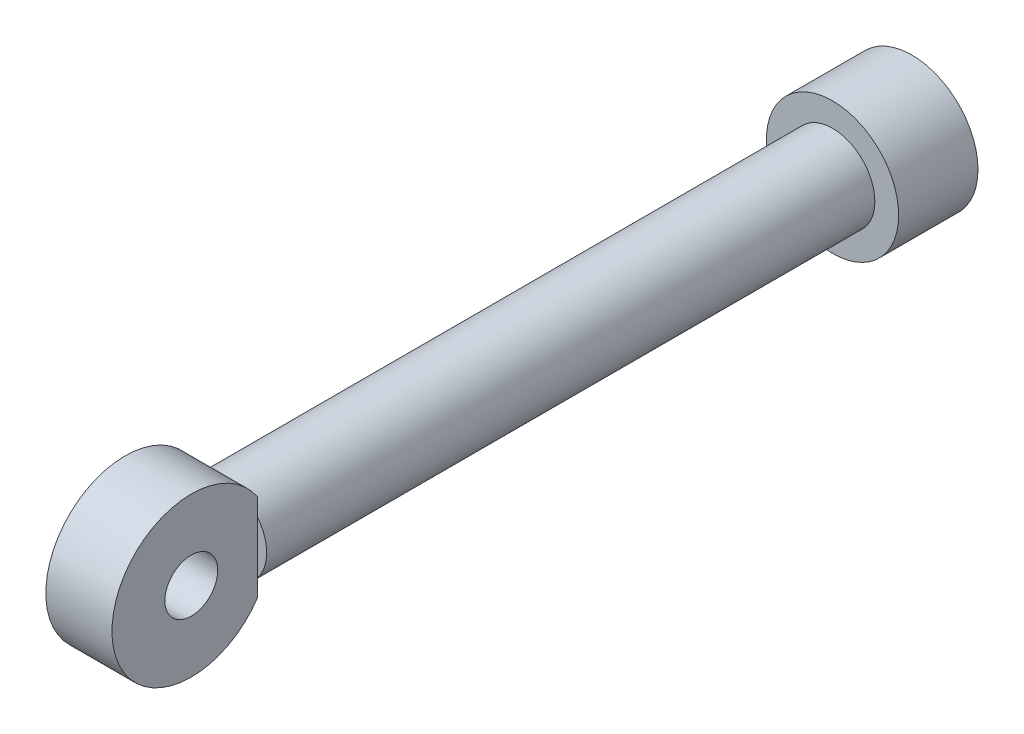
SolidWorks part; units mm, degrees
ref_plane "前视基准面" through (0, 0, 0) normal (0, 0, 1) x (1, 0, 0)
ref_plane "上视基准面" through (0, 0, 0) normal (0, 1, 0) x (1, 0, 0)
ref_plane "右视基准面" through (0, 0, 0) normal (1, 0, 0) x (0, 0, -1)
sketch "草图1" plane through (0, 0, 0) normal (0, 0, 1) x (1, 0, 0)
  circle A0 centre (0, 0) radius 25
  dimension "D1" = 50
extrude "拉伸1" add sketch "草图1" along normal blind 30
sketch "草图2" plane through (0, 0, 30) normal (0, 0, 1) x (1, 0, 0)
  circle A0 centre (0, 0) radius 16
  dimension "D1" = 32
extrude "拉伸2" add sketch "草图2" along normal blind 230
sketch "草图3" plane through (0, 0, 0) normal (1, 0, 0) x (0, 0, -1)
  line L0 (-95.6985, 0) -> (-243.9232, 0) construction
  line L1 (-260, 16) -> (-260, -16) construction
  line L2 (-260, 16.5831) -> (-260, -16.5831)
  arc A0 (-260, 16.5831) -> (-260, -16.5831) centre (-285, 0) ccw
  circle A1 centre (-285, 0) radius 10
  dimension "D1" = 60
  dimension "D3" = 20
  dimension "D2" = 25
extrude "拉伸3" add sketch "草图3" along normal mid plane 25
